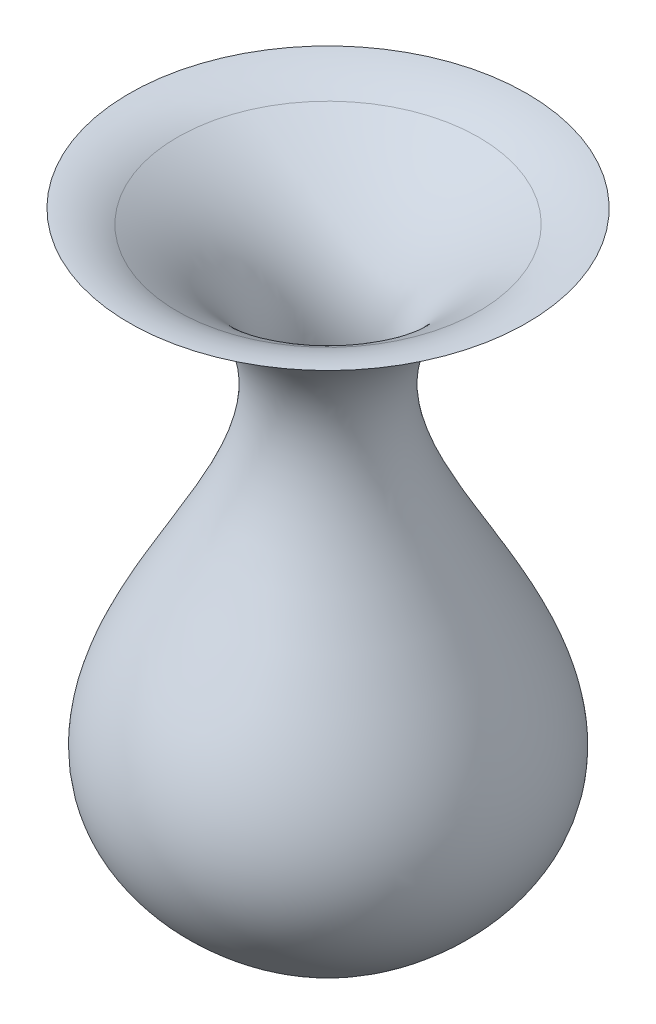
SolidWorks part; units mm, degrees
ref_plane "Front Plane" through (0, 0, 0) normal (0, 0, 1) x (1, 0, 0)
ref_plane "Top Plane" through (0, 0, 0) normal (0, 1, 0) x (1, 0, 0)
ref_plane "Right Plane" through (0, 0, 0) normal (1, 0, 0) x (0, 0, -1)
sketch "Sketch1" plane through (0, 0, 0) normal (0, 0, 1) x (1, 0, 0)
  line L0 (0, 0) -> (0, 60)
  line L1 (0, 60) -> (20, 60)
  line L2 (0, 0) -> (10, 0)
  spline S0 degree 3 poles (20, 60) (-18.1654, 42.306) (38.7774, 19.6098) (10, 0) knots 0 0 0 0 1 1 1 1
  point P6 (0, 0)
  dimension "D1" = 60
  dimension "D2" = 20
  dimension "D3" = 10
  dimension "D4" = 16
  dimension "D5" = 40
revolve "Revolve1" add sketch "Sketch1" angle 360 about L0
sketch "Sketch2" plane through (0, 60, 0) normal (0, 1, 0) x (1, 0, 0)
  circle A2 centre (0, 0) radius 20
  circle A3 centre (0, 0) radius 20
  point P0 (0, 0)
  dimension "D1" = 0
sketch "Sketch5" plane through (0, 0, 0) normal (0, 0, 1) x (1, 0, 0)
  line L0 (20, 60) -> (-20, 60) construction
  line L1 (0, 0) -> (0, 60) construction
  spline S0 degree 3 poles (0, 0) (50.3674, 13.9112) (-22.4989, 41.0276) (13, 60) knots 0 0 0 0 1 1 1 1
  spline S1 degree 3 poles (10, 0) (38.7774, 19.6098) (-18.1654, 42.306) (20, 60) knots 0 0 0 0 1 1 1 1 construction
  dimension "D1" = 18
  dimension "D2" = 17.717
  dimension "D3" = 3
  dimension "D4" = 7
  dimension "D5" = 45
shell "Shell1" thickness 1
fillet "Fillet3" radius 10 1 edges at (0, 60, -17.7119)
fillet "Fillet4" radius 10 1 edges at (0, 1, -9.6893)
